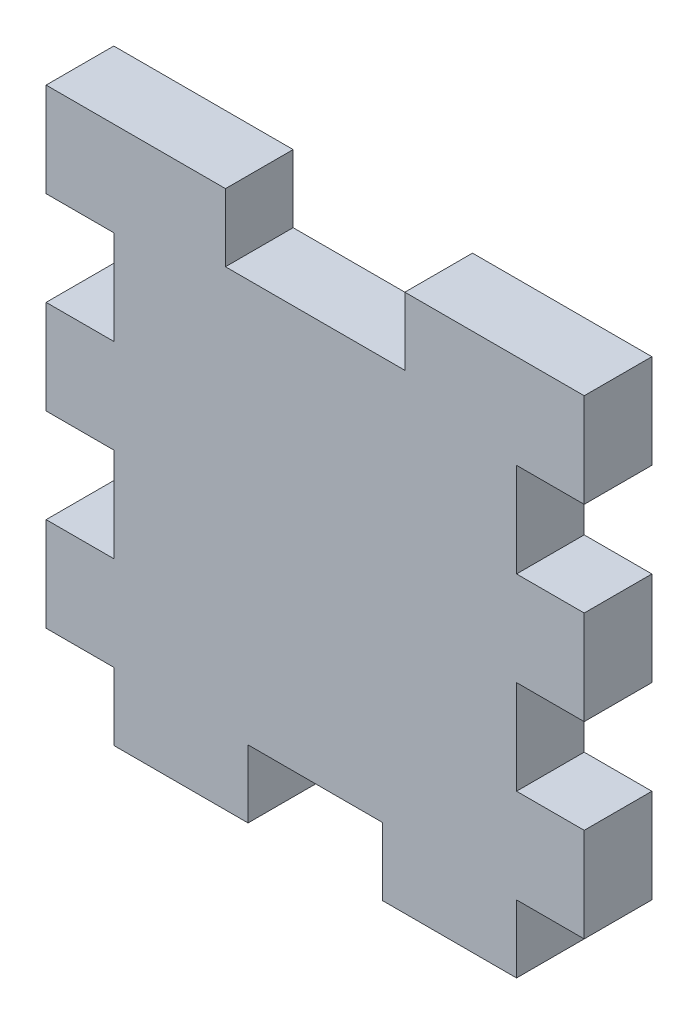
SolidWorks part; units mm, degrees
ref_plane "Front Plane" through (0, 0, 0) normal (0, 0, 1) x (1, 0, 0)
ref_plane "Top Plane" through (0, 0, 0) normal (0, 1, 0) x (1, 0, 0)
ref_plane "Right Plane" through (0, 0, 0) normal (1, 0, 0) x (0, 0, -1)
sketch "Sketch1" plane through (0, 0, 0) normal (0, 0, 1) x (1, 0, 0)
  line L0 (15.875, 15.875) -> (-15.875, 15.875)
  line L1 (-15.875, -15.875) -> (15.875, -15.875)
  line L2 (-15.875, -15.875) -> (-15.875, 15.875)
  line L4 (15.875, -15.875) -> (15.875, 15.875)
  line L5 (-15.875, -15.875) -> (15.875, 15.875) construction
  line L6 (-15.875, 15.875) -> (15.875, -15.875) construction
  point P0 (0, 0)
  dimension "D1" = 31.75
  dimension "D2" = 31.75
extrude "Boss-Extrude1" add sketch "Sketch1" along normal blind 5.334
sketch "Sketch4" plane through (0, 0, 5.334) normal (0, 0, 1) x (1, 0, 0)
  line L1 (-15.875, -15.875) -> (-15.875, 15.875)
  line L2 (-15.875, 15.875) -> (15.875, 15.875)
  line L3 (15.875, 15.875) -> (-15.875, 15.875) construction
  line L4 (-15.875, 21.209) -> (15.875, 21.209)
  line L5 (15.875, 15.875) -> (15.875, -15.875)
  line L6 (-15.875, -15.875) -> (-21.209, -15.875)
  line L8 (15.875, -15.875) -> (-15.875, -15.875)
  line L9 (-15.875, 21.209) -> (-21.209, 21.209)
  line L10 (-21.209, -15.875) -> (-21.209, 21.209)
  line L11 (15.875, 21.209) -> (21.209, 21.209)
  line L12 (-15.875, 15.875) -> (-15.875, 21.209) construction
  line L13 (15.875, -15.875) -> (21.209, -15.875)
  line L14 (21.209, 21.209) -> (21.209, -15.875)
  line L16 (15.875, -15.875) -> (15.875, -21.209)
  line L17 (15.875, -21.209) -> (-15.875, -21.209)
  line L18 (-15.875, -15.875) -> (-15.875, -21.209)
  dimension "D1" = 5.334
  dimension "D2" = 5.334
  dimension "D3" = 5.334
  dimension "D4" = 5.334
  dimension "D5" = 5.334
extrude "Boss-Extrude6" add sketch "Sketch4" against normal through all contours L12 L9 L10 L6 M3 | L12 L13 L14 L11 L4 M2 M1 | L18 L17 L16 M4
sketch "Sketch7" plane through (0, 0, 5.334) normal (0, 0, 1) x (1, 0, 0)
  line L0 (-21.209, -15.875) -> (-21.209, 21.209) construction
  line L1 (-21.209, -8.4582) -> (-15.875, -8.4582)
  line L2 (-21.209, -8.4582) -> (-21.209, -1.0414)
  line L3 (-21.209, -1.0414) -> (-15.875, -1.0414)
  line L4 (-15.875, -8.4582) -> (-15.875, -1.0414)
  line L5 (-15.875, -15.875) -> (-15.875, -8.4582) construction
  line L6 (-21.209, 6.3754) -> (-15.875, 6.3754)
  line L7 (-21.209, 6.3754) -> (-21.209, 13.7922)
  line L8 (-21.209, 13.7922) -> (-15.875, 13.7922)
  line L9 (-15.875, 6.3754) -> (-15.875, 13.7922)
  line L10 (-15.875, -1.0414) -> (-15.875, 6.3754) construction
  line L11 (21.209, 21.209) -> (-21.209, 21.209) construction
  line L12 (-15.875, 13.7922) -> (-15.875, 21.209) construction
  line L13 (0, 0) -> (0, 21.209) construction
  line L14 (15.875, 13.7922) -> (15.875, 21.209) construction
  line L15 (15.875, -1.0414) -> (15.875, 6.3754) construction
  line L16 (15.875, -15.875) -> (15.875, -8.4582) construction
  line L17 (15.875, 6.3754) -> (15.875, 13.7922)
  line L18 (21.209, 13.7922) -> (15.875, 13.7922)
  line L19 (21.209, 6.3754) -> (21.209, 13.7922)
  line L20 (21.209, 6.3754) -> (15.875, 6.3754)
  line L21 (15.875, -8.4582) -> (15.875, -1.0414)
  line L22 (21.209, -1.0414) -> (15.875, -1.0414)
  line L23 (21.209, -8.4582) -> (21.209, -1.0414)
  line L24 (21.209, -8.4582) -> (15.875, -8.4582)
extrude "Cut-Extrude2" cut sketch "Sketch7" against normal through all
sketch "Sketch8" plane through (0, 0, 5.334) normal (0, 0, 1) x (1, 0, 0)
  line L1 (21.209, 21.209) -> (-21.209, 21.209) construction
  line L2 (-7.0697, 21.209) -> (7.0697, 21.209)
  line L3 (-7.0697, 21.209) -> (-7.0697, 15.875)
  line L4 (-7.0697, 15.875) -> (7.0697, 15.875)
  line L5 (7.0697, 21.209) -> (7.0697, 15.875)
  line L11 (-7.0697, 15.875) -> (-21.209, 15.875) construction
  line L16 (-21.209, 13.7922) -> (-21.209, 21.209) construction
  line L17 (7.0697, 15.875) -> (21.209, 15.875) construction
  line L18 (21.209, 21.209) -> (21.209, 13.7922) construction
  dimension "D1" = 5.334
extrude "Cut-Extrude3" cut sketch "Sketch8" against normal through all
sketch "Sketch9" plane through (0, 0, 5.334) normal (0, 0, 1) x (1, 0, 0)
  line L2 (15.875, -21.209) -> (-15.875, -21.209) construction
  line L3 (-5.2917, -15.875) -> (5.2917, -15.875)
  line L4 (-5.2917, -15.875) -> (-5.2917, -21.209)
  line L5 (-5.2917, -21.209) -> (5.2917, -21.209)
  line L6 (5.2917, -15.875) -> (5.2917, -21.209)
  line L7 (-5.2917, -15.875) -> (-15.875, -15.875) construction
  line L8 (5.2917, -15.875) -> (15.875, -15.875) construction
extrude "Cut-Extrude5" cut sketch "Sketch9" against normal through all
equation "\"D1@Boss-Extrude1\"=\"material\""
equation "\"material\"=\"MDF@Platform.assembly\""
